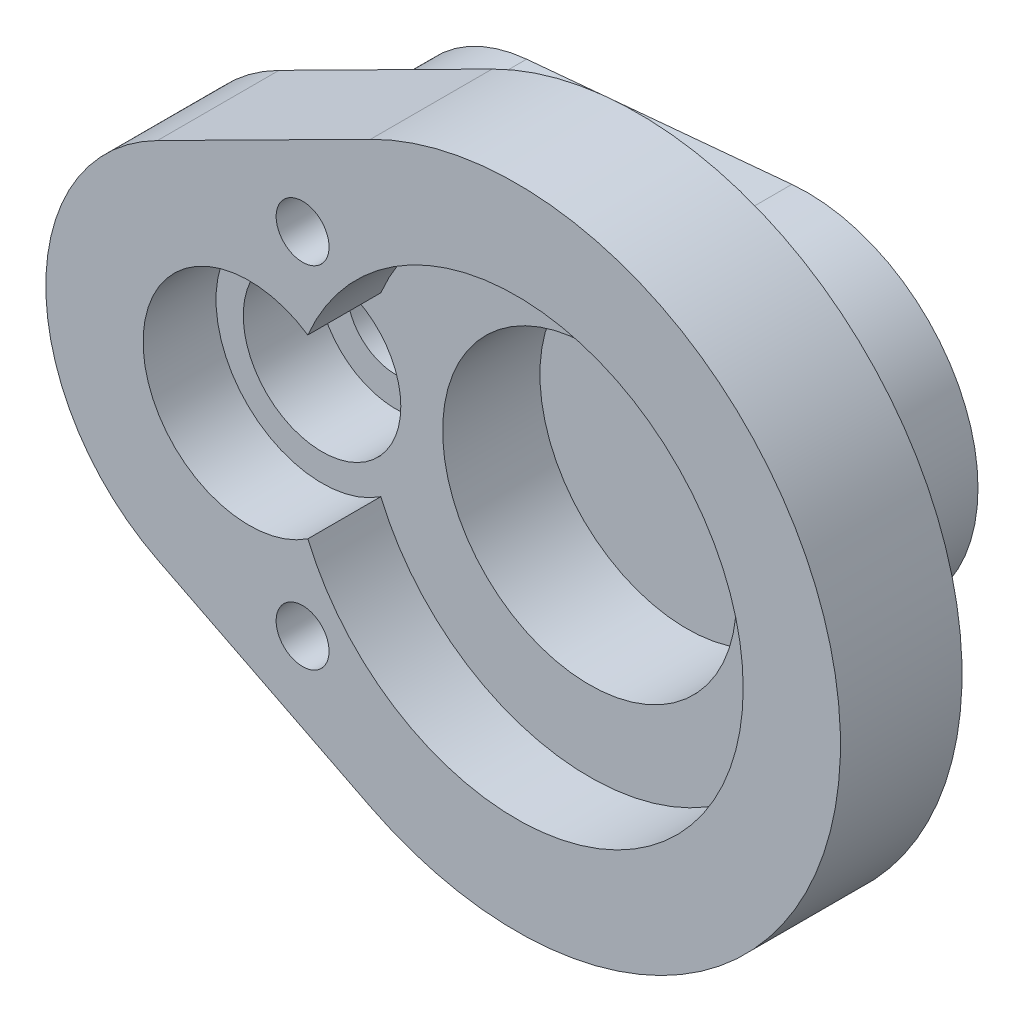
SolidWorks part; units mm, degrees
ref_plane "Front Plane" through (0, 0, 0) normal (0, 0, 1) x (1, 0, 0)
ref_plane "Top Plane" through (0, 0, 0) normal (0, 1, 0) x (1, 0, 0)
ref_plane "Right Plane" through (0, 0, 0) normal (1, 0, 0) x (0, 0, -1)
sketch "Sketch3" plane through (0, 0, 0) normal (0, 0, 1) x (1, 0, 0)
  line L0 (-18.3307, 9.5109) -> (-1.0125, 11.0918)
  line L1 (-18.3307, -9.5109) -> (-1.0125, -11.0918)
  arc A0 (-1.0125, -11.0918) -> (-1.0125, 11.0918) centre (0, 0) ccw
  arc A1 (-18.3307, 9.5109) -> (-18.3307, -9.5109) centre (-17.4625, 0) ccw
extrude "Boss-Extrude2" add sketch "Sketch3" along normal blind 6.35
sketch "Sketch5" plane through (0, 0, 6.35) normal (0, 0, 1) x (1, 0, 0)
  line L2 (-19.984, 9.5797) -> (-3.653, 13.8783)
  line L3 (-19.984, -9.5797) -> (-3.653, -13.8783)
  arc A2 (-3.653, -13.8783) -> (-3.653, 13.8783) centre (0, 0) ccw
  arc A3 (-19.984, 9.5797) -> (-19.984, -9.5797) centre (-17.4625, 0) ccw
extrude "Boss-Extrude3" add sketch "Sketch5" along normal blind 4.699
sketch "Sketch7" plane through (0, 0, 11.049) normal (0, 0, 1) x (1, 0, 0)
  line L0 (-20.5835, 6.1779) -> (-6.6714, 13.206) construction
  line L1 (-20.5835, -6.1779) -> (-6.6714, -13.206) construction
  line L2 (-23.4467, -11.8457) -> (-9.5347, -18.8738)
  line L3 (-23.4467, 11.8457) -> (-9.5347, 18.8738)
  arc A0 (-6.6714, -13.206) -> (-6.6714, 13.206) centre (0, 0) ccw construction
  arc A1 (-20.5835, 6.1779) -> (-20.5835, -6.1779) centre (-17.4625, 0) ccw construction
  arc A2 (-9.5347, -18.8738) -> (-9.5347, 18.8738) centre (0, 0) ccw
  arc A3 (-23.4467, 11.8457) -> (-23.4467, -11.8457) centre (-17.4625, 0) ccw
extrude "Boss-Extrude4" add sketch "Sketch7" along normal blind 7.9375
sketch "Sketch8" plane through (0, 0, 18.9865) normal (0, 0, 1) x (1, 0, 0)
  circle A1 centre (-17.4625, 0) radius 3.2004
extrude "Cut-Extrude1" cut sketch "Sketch8" against normal through all
sketch "Sketch9" plane through (0, 0, 18.9865) normal (0, 0, 1) x (1, 0, 0)
  arc A0 (-13.6274, -5.7619) -> (-13.6274, 5.7619) centre (0, 0) ccw
  arc A1 (-13.6274, 5.7619) -> (-13.6274, -5.7619) centre (-17.4625, 0) ccw
extrude "Cut-Extrude2" cut sketch "Sketch9" against normal blind 4.7625
sketch "Sketch10" plane through (0, 0, 14.224) normal (0, 0, 1) x (1, 0, 0)
  circle A0 centre (0, 0) radius 9.5885
extrude "Cut-Extrude3" cut sketch "Sketch10" against normal blind 6.35
sketch "Sketch11" plane through (0, 0, 14.224) normal (0, 0, 1) x (1, 0, 0)
  circle A0 centre (-17.4625, 0) radius 5.1435
extrude "Cut-Extrude4" cut sketch "Sketch11" against normal blind 4.826
sketch "Sketch17" plane through (0, 0, 18.9865) normal (0, 0, 1) x (1, 0, 0)
  line L0 (10.4426, 0) -> (-10.4426, 0) construction
  line L1 (0, -10.4426) -> (0, 10.4426) construction
  point P0 (-13.97, 11.43)
  point P2 (-13.97, -11.43)
  dimension "D1" = 11.43
  dimension "D2" = 11.43
  dimension "D3" = 13.97
  dimension "D4" = 13.97
hole_wizard "#8-32 Tapped Hole2" positions "Sketch17" profile "Sketch16" tap size "#8-32" standard "ANSI Inch"
sketch "Sketch16" plane through (-13.97, 11.43, 18.9865) normal (1, 0, 0) x (0, -1, 0)
  line L0 (0, 0) -> (0, 7.3878)
  line L1 (0, 7.3878) -> (1.7272, 6.35)
  line L2 (1.7272, 6.35) -> (1.7272, 0)
  line L5 (1.7272, 0) -> (0, 0)
  line L10 (0, 7.3878) -> (-1.7272, 6.35) construction
  line L11 (0, -6.35) -> (0, 107.95) construction
  dimension "Tap Drill Dia." = 3.4544
  dimension "Tap Drill Depth" = 6.35
  dimension "Drill Angle" = 118
equation "\"G\"= 1in'Gear - Gear Pitch Diameter"
equation "\"P\"= 3 / 8in'Pinion - Gear Pitch Diameter"
equation "\"MountDist\"= ( \"G\" + \"P\" ) / 2in'Mounting Distance"
equation "\"Ghd\"= 0.63in'Gear - Gear Hub Diameter"
equation "\"Ghw\"= 0.25in'Gear - Gear Hub Width"
equation "\"Gw\"= 0.375in'Gear - Overall Width"
equation "\"Phd\"= 0.28in'Pinion - Gear Hub Diameter"
equation "\"Phw\"= 0.19in'Pinion - Gear Hub Width"
equation "\"Pw\"= .315'Pinion - Overall Width"
equation "\"GD\"= 1.04in'Gear - Outer Diameter"
equation "\"PD\"= 0.42in'Pininon - Outer Diameter"
equation "\"inJB\"= 0.252in'Input Journal Bearing - Outer Diameter"
equation "\"outJB\"= 0.377in'Output Journal Bearing - Outer Diameter"
equation "\"L_JB\"= 0.25in'Journal Bearing Length"
equation "\"Ht\"= 0.25in'Housing Thickness"
equation "\"D1@Sketch3\"=\"outJB\" + 2* \"Ht\""
equation "\"D2@Sketch3\"=\"inJB\" + 2* \"Ht\""
equation "\"D3@Sketch3\"=\"MountDist\""
equation "\"D1@Boss-Extrude2\"=\"L_JB\""
equation "\"D1@Boss-Extrude3\"=\"Ghw\" - \"Phw\" + \"clear\""
equation "\"D1@Sketch5\"=\"Ghd\" + 2* \"Ht\""
equation "\"D2@Sketch5\"=\"Phd\" + 2* \"Ht\""
equation "\"D1@Sketch7\"=\"GD\" + \"clear\""
equation "\"D2@Sketch7\"=\"PD\"+ \"clear\""
equation "\"D3@Sketch7\"=\"Ht\""
equation "\"D1@Boss-Extrude4\"=\"Gw\"-\"Ghw\" + \"clear\" *3/2"
equation "\"D2@Sketch8\"=\"inJB\""
equation "\"D1@Sketch9\"=\"GD\"+.125"
equation "\"D2@Sketch9\"=\"PD\"+.125"
equation "\"D1@Cut-Extrude2\"=\"Gw\"-\"Ghw\"+ \"clear\"/2"
equation "\"D1@Sketch10\"=\"Ghd\"+.125"
equation "\"D1@Cut-Extrude3\"=\"Ghw\""
equation "\"D1@Sketch11\"=\"Phd\"+.125"
equation "\"clear\"= 0.125in'Clearance for moving parts"
